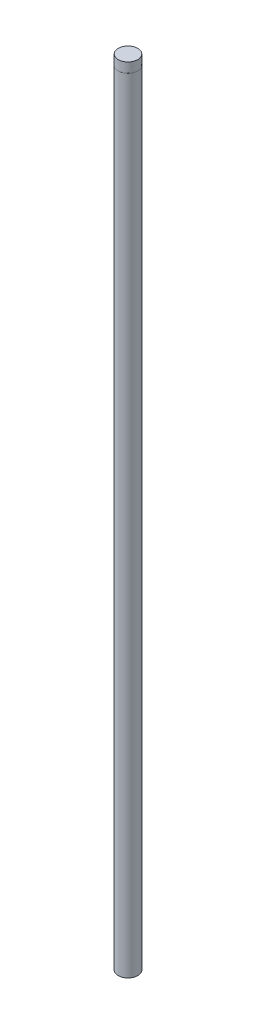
SolidWorks part; units mm, degrees
ref_plane "Front" through (0, 0, 0) normal (0, 0, 1) x (1, 0, 0)
ref_plane "Top" through (0, 0, 0) normal (0, 1, 0) x (1, 0, 0)
ref_plane "Right" through (0, 0, 0) normal (1, 0, 0) x (0, 0, -1)
sketch "Sketch1" plane through (0, 0, 0) normal (0, 0, 1) x (1, 0, 0)
  line L0 (0, 0) -> (5, 0) construction
  line L1 (5, 0) -> (5, 5) construction
  line L2 (5, 5) -> (11, 5) construction
  line L3 (11, 5) -> (11, 486) construction
  line L4 (11, 486) -> (0, 486)
  line L5 (0, 486) -> (0, 0) construction
  line L6 (4.99, 886) -> (4.99, 891)
  line L7 (0, 886) -> (5, 886)
  line L8 (0, 886) -> (0, 486)
  line L9 (0, 486) -> (5, 486) construction
  line L10 (5, 886) -> (5, 486)
  line L11 (0, 886) -> (5, 886)
  line L12 (0, 886) -> (0, 891)
  line L13 (0, 891) -> (4.99, 891)
  dimension "D1" = 11
  dimension "D2" = 5
  dimension "D3" = 5
  dimension "D4" = 881
  dimension "D5" = 400
  dimension "D6" = 5
  dimension "D7" = 5
  dimension "D8" = 4.99
revolve "Revolve1" add sketch "Sketch1" angle 360 about L8
